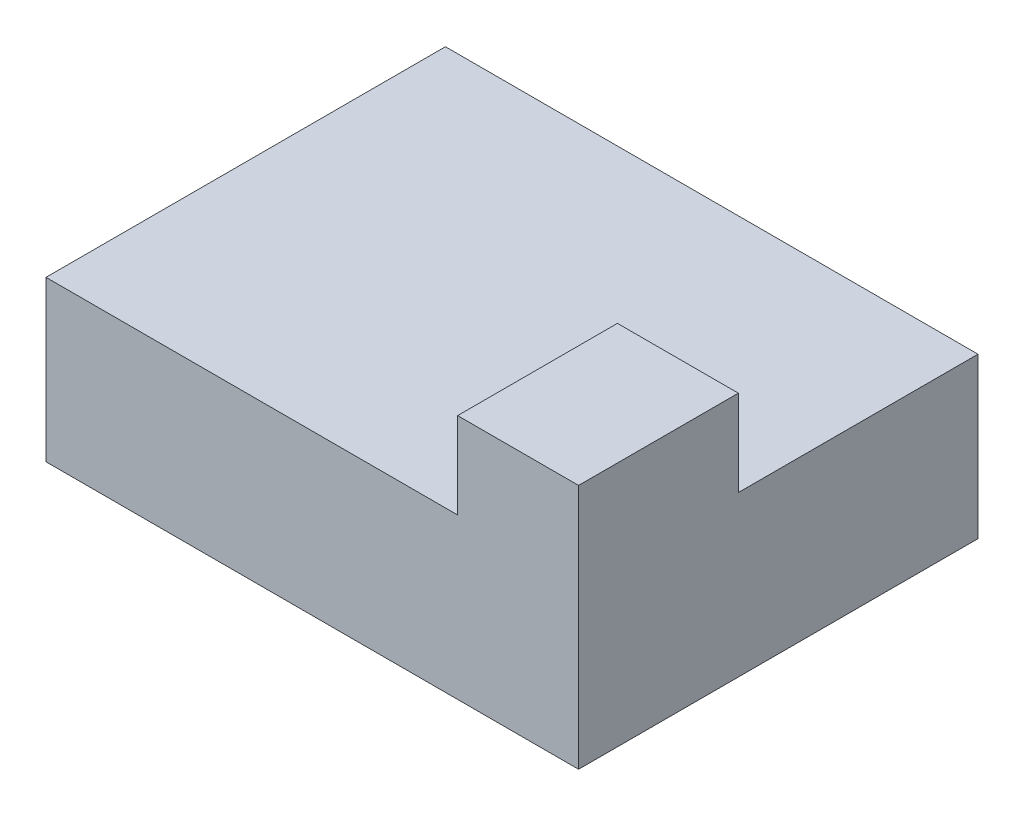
SolidWorks part; units mm, degrees
ref_plane "Front" through (0, 0, 0) normal (0, 0, 1) x (1, 0, 0)
ref_plane "Top" through (0, 0, 0) normal (0, 1, 0) x (1, 0, 0)
ref_plane "Right" through (0, 0, 0) normal (1, 0, 0) x (0, 0, -1)
sketch "Sketch1" plane through (0, 0, 0) normal (0, 1, 0) x (1, 0, 0)
  line L0 (50, -37.5) -> (-50, 37.5) construction
  line L1 (-50, 37.5) -> (50, 37.5)
  line L2 (-50, 37.5) -> (-50, -37.5)
  line L3 (-50, -37.5) -> (50, -37.5)
  line L4 (50, 37.5) -> (50, -37.5)
  point P4 (0, 0)
  dimension "D1" = 100
  dimension "D2" = 75
extrude "Extrude1" add sketch "Sketch1" along normal blind 30
sketch "Sketch7" plane through (0, 0, 37.5) normal (0, 0, 1) x (1, 0, 0)
  line L0 (-50, 30) -> (50, 30) construction
  line L1 (27.2944, 30) -> (50, 30)
  line L2 (27.2944, 30) -> (27.2944, 46.1617)
  line L3 (27.2944, 46.1617) -> (50, 46.1617)
  line L4 (50, 30) -> (50, 46.1617)
extrude "Extrude9" add sketch "Sketch7" against normal blind 30
